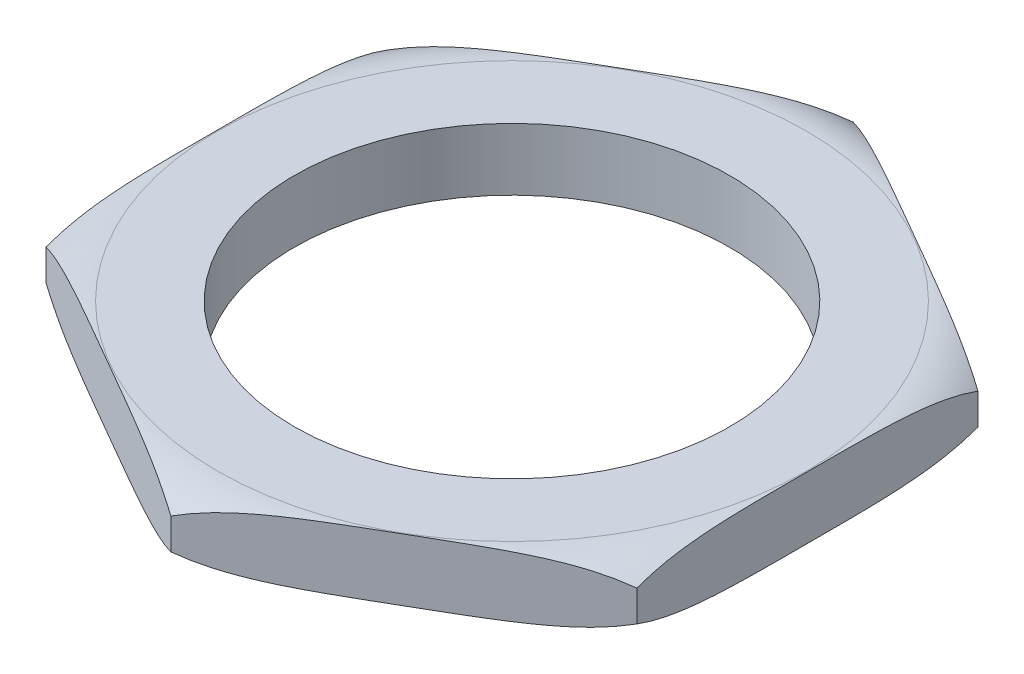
SolidWorks part; units mm, degrees
ref_plane "Alzado" through (0, 0, 0) normal (0, 0, 1) x (1, 0, 0)
ref_plane "Planta" through (0, 0, 0) normal (0, 1, 0) x (1, 0, 0)
ref_plane "Vista lateral" through (0, 0, 0) normal (1, 0, 0) x (0, 0, -1)
sketch "Croquis1" plane through (0, 0, 0) normal (0, 1, 0) x (1, 0, 0)
  line L0 (0, 0) -> (0, 21.9393) construction
  line L1 (0, 21.9393) -> (-19, 10.9697)
  line L2 (-19, 10.9697) -> (-19, -10.9697)
  line L3 (-19, -10.9697) -> (0, -21.9393)
  line L4 (0, -21.9393) -> (19, -10.9697)
  line L5 (19, -10.9697) -> (19, 10.9697)
  line L6 (19, 10.9697) -> (0, 21.9393)
  circle A0 centre (0, 0) radius 14
  circle A1 centre (0, 0) radius 19 construction
  dimension "D1" = 28
  dimension "D2" = 38
extrude "Saliente-Extruir1" add sketch "Croquis1" along normal blind 4
sketch "Croquis2" plane through (0, 0, 0) normal (1, 0, 0) x (0, 0, -1)
  line L0 (-18.9393, 4) -> (-21.9393, 4)
  line L1 (-21.9393, 4) -> (-10.9697, 4) construction
  line L2 (-21.9393, 4) -> (-21.9393, 3)
  line L3 (-21.9393, 4) -> (-21.9393, 0) construction
  line L4 (0, 4) -> (0, 0) construction
  line L5 (-10.9697, 4) -> (10.9697, 4) construction
  line L6 (0, 0) -> (0, 2) construction
  line L7 (0, 2) -> (-21.9393, 2) construction
  line L8 (-18.9393, 0) -> (-21.9393, 0)
  line L9 (-21.9393, 0) -> (-21.9393, 1)
  arc A0 (-21.9393, 3) -> (-18.9393, 4) centre (-18.9393, -1) cw
  arc A1 (-21.9393, 1) -> (-18.9393, 0) centre (-18.9393, 5) ccw
  dimension "D1" = 3
  dimension "D2" = 1
revolve "Cortar-Revolución1" cut sketch "Croquis2" angle 360 about L4
